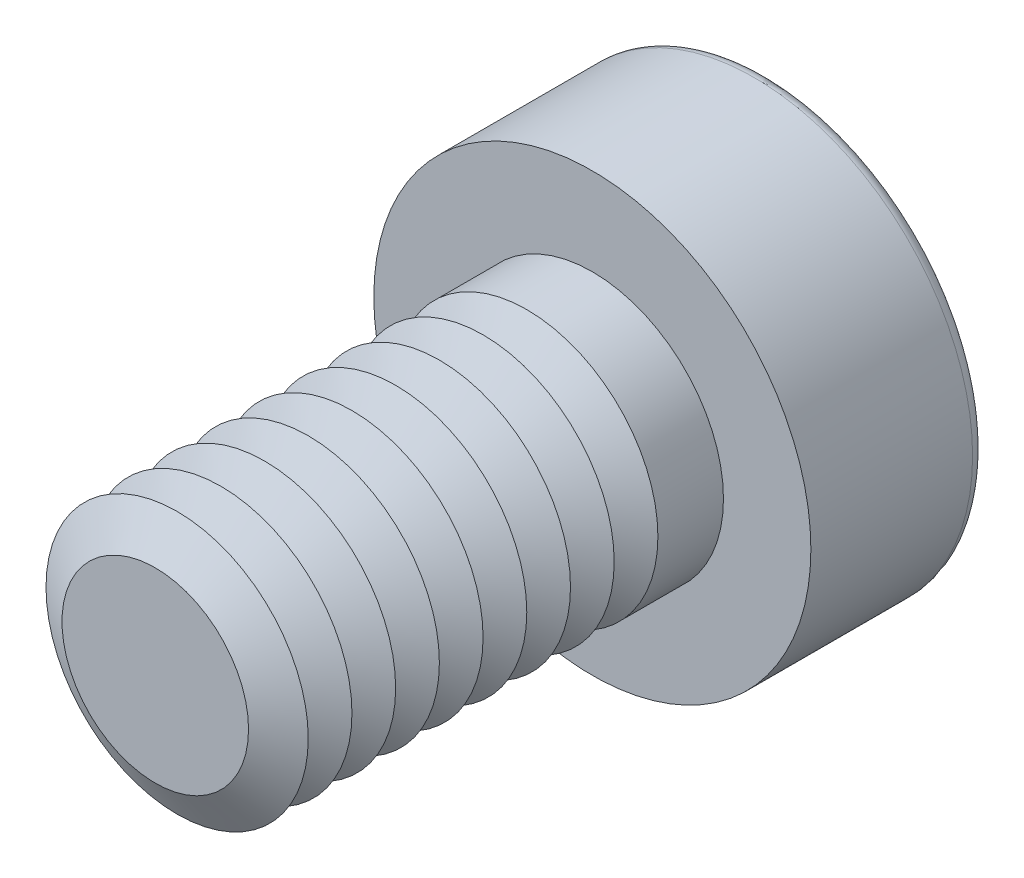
SolidWorks part; units mm, degrees
ref_plane "Front Plane" through (0, 0, 0) normal (0, 0, 1) x (1, 0, 0)
ref_plane "Top Plane" through (0, 0, 0) normal (0, 1, 0) x (1, 0, 0)
ref_plane "Right Plane" through (0, 0, 0) normal (1, 0, 0) x (0, 0, -1)
sketch "Sketch1" plane through (0, 0, 0) normal (0, 0, 1) x (1, 0, 0)
  circle A0 centre (0, 0) radius 3
  dimension "D1" = 6
extrude "Boss-Extrude1" add sketch "Sketch1" along normal blind 10
sketch "Sketch2" plane through (0, 0, 0) normal (0, 0, -1) x (-1, 0, 0)
  circle A0 centre (0, 0) radius 5
  dimension "D1" = 10
extrude "Boss-Extrude2" add sketch "Sketch2" along normal blind 4
sketch "Sketch3" plane through (0, 0, -4) normal (0, 0, -1) x (-1, 0, 0)
  line L1 (-1.1547, 2) -> (-2.3094, 0)
  line L2 (-2.3094, 0) -> (-1.1547, -2)
  line L3 (-1.1547, -2) -> (1.1547, -2)
  line L4 (1.1547, -2) -> (2.3094, 0)
  line L5 (2.3094, 0) -> (1.1547, 2)
  line L6 (1.1547, 2) -> (-1.1547, 2)
  circle A0 centre (0, 0) radius 2 construction
  dimension "D1" = 4
extrude "Cut-Extrude1" cut sketch "Sketch3" against normal blind 3
fillet "Fillet1" radius 0.3 1 edges at (-5, 0, -4)
sketch "Sketch4" plane through (0, 0, -1) normal (0, 0, -1) x (-1, 0, 0)
  line L0 (1.1547, -2) -> (2.3094, 0) construction
  circle A0 centre (0, 0) radius 2
extrude "Cut-Extrude2" cut sketch "Sketch4" against normal through all draft 60
sketch "Sketch5" plane through (0, 0, -4) normal (0, 0, -1) x (-1, 0, 0)
  circle A0 centre (0, 0) radius 2.3094
extrude "Cut-Extrude3" cut sketch "Sketch5" against normal through all draft 75
sketch "Sketch7" plane through (0, 0, 0) normal (1, 0, 0) x (0, 0, -1)
  line L25 (-10, 2.134) -> (-9.5, 3)
  line L26 (-10, 3) -> (-10, -3) construction
  line L27 (-9.5, 3) -> (-10.5, 3)
  line L28 (-10.5, 3) -> (-10, 2.134)
  line L29 (0, 3) -> (-10, 3) construction
  dimension "D1" = 1
revolve "Cut-Revolve1" cut sketch "Sketch7" angle 360 about axis through (0, 0, 10) along (0, 0, -1)
pattern_linear "LPattern1" count 9 spacing 1 along (0, 0, -1) of "Cut-Revolve1"
